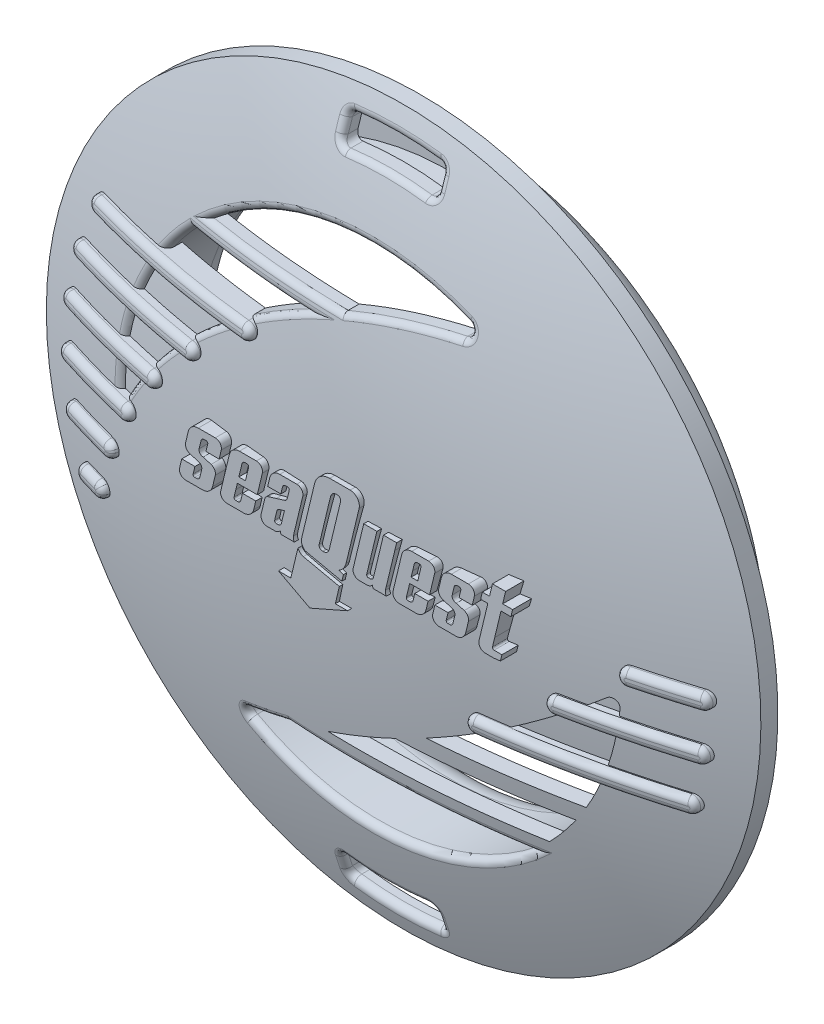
SolidWorks part; units mm, degrees
ref_plane "Plane1" through (0, 0, 0) normal (0, 0, 1) x (1, 0, 0)
ref_plane "Plane2" through (0, 0, 0) normal (0, 1, 0) x (1, 0, 0)
ref_plane "Plane3" through (0, 0, 0) normal (1, 0, 0) x (0, 0, -1)
sketch "Sketch1" plane through (0, 0, 0) normal (1, 0, 0) x (0, 0, -1)
  line L0 (0, 0) -> (10.1709, 0) construction
  line L1 (5.0468, 28.448) -> (6.4007, 28.448)
  line L2 (0, 0) -> (1.27, 0)
  arc A0 (0, 0) -> (5.0468, 28.448) centre (82.7024, 0) cw
  arc A1 (1.27, 0) -> (6.4007, 28.448) centre (82.7024, 0) cw
  point P6 (5.0468, 28.448)
  point P8 (5.0468, -28.448)
  dimension "D1" = 1.27
  dimension "D3" = 56.896
  dimension "D4" = 5.0468
revolve "Main Body" add sketch "Sketch1" angle 180 about L0
sketch "Save Body Profile" plane through (0, 0, 0) normal (1, 0, 0) x (0, 0, -1)
  line L0 (5.0468, 28.448) -> (6.4007, 28.448) construction
  line L1 (5.4526, 28.448) -> (6.4007, 28.448)
  line L2 (0.381, 0) -> (1.27, 0)
  arc A2 (5.4526, 28.448) -> (0.381, 0) centre (82.7024, 0) ccw
  arc A3 (6.4007, 28.448) -> (1.27, 0) centre (82.7024, 0) ccw
sketch "Body Front Edge" plane through (0, 0, 0) normal (1, 0, 0) x (0, 0, -1)
  arc A0 (5.0468, 28.448) -> (5.0468, -28.448) centre (82.7024, 0) ccw construction
  arc A1 (5.0468, 28.448) -> (0, 0) centre (82.7024, 0) ccw
sketch "Sketch2" plane through (0, 0, 0) normal (1, 0, 0) x (0, 0, -1)
  line L0 (0, 0) -> (14.5861, 0) construction
  line L1 (4.29, 21.971) -> (8.763, 21.971)
  line L2 (8.763, 21.971) -> (8.763, 24.257)
  line L3 (8.763, 19.939) -> (3.7488, 19.939)
  line L4 (5.0468, 28.448) -> (6.4007, 28.448) construction
  arc A0 (6.4007, 28.448) -> (6.4007, -28.448) centre (82.7024, 0) ccw construction
  arc A1 (4.29, 21.971) -> (3.7488, 19.939) centre (82.7024, 0) ccw
  arc A2 (8.763, 19.939) -> (8.763, 24.257) centre (8.763, 22.098) ccw
  point P13 (4.29, 21.971)
  point P14 (4.29, -21.971)
  dimension "D1" = 8.509
  dimension "D2" = 8.763
  dimension "D3" = 2.032
  dimension "D4" = 2.286
revolve "Snap Ring" add sketch "Sketch2" angle 180 about L0
mirror "Boss-Mirror1"
sketch "Vent OD" plane through (0, 0, 0) normal (0, 0, 1) x (1, 0, 0)
  circle A0 centre (0, 0) radius 19.939
  circle A1 centre (0, 0) radius 19.939 construction
sketch "Sketch3" plane through (0, 0, 0) normal (0, 0, 1) x (1, 0, 0)
  line L0 (17.5822, 0) -> (-17.5822, 0) construction
  line L1 (0, -17.5822) -> (0, 17.5822) construction
  line L2 (9.3514, 17.6101) -> (-19.9105, -1.0652) construction
  arc A0 (9.3514, 17.6101) -> (-19.9105, -1.0652) centre (11.9634, -18.7452) ccw
  arc A1 (9.3514, 17.6101) -> (-19.9105, -1.0652) centre (0, 0) ccw
  circle A2 centre (0, 0) radius 19.939 construction
  dimension "D3" = 9.3514
  dimension "D1" = 1.0652
  dimension "D4" = 4.3979
extrude "Upper Left Vent Cut" cut sketch "Sketch3" against normal through all
sketch "Sketch4" plane through (0, 0, 0) normal (0, 0, 1) x (1, 0, 0)
  line L0 (19.923, -0.7977) -> (-10.6858, -16.8338) construction
  line L1 (17.5822, 0) -> (-17.5822, 0) construction
  line L2 (0, -17.5822) -> (0, 17.5822) construction
  arc A0 (19.923, -0.7977) -> (-10.6858, -16.8338) centre (-32.8422, 62.6872) cw
  arc A1 (19.923, -0.7977) -> (-10.6858, -16.8338) centre (0, 0) cw
  circle A2 centre (0, 0) radius 19.939 construction
  dimension "D3" = 1.8283
  dimension "D1" = 0.7977
  dimension "D2" = 10.6858
extrude "Lower Right Vent Cut" cut sketch "Sketch4" against normal through all
sketch "Sketch6" plane through (0, 0, 0) normal (1, 0, 0) x (0, 0, -1)
  line L0 (0, 0) -> (12.1279, 0) construction
  line L1 (5.4526, 28.448) -> (6.4007, 28.448)
  line L2 (0.381, 0) -> (1.27, 0)
  arc A0 (1.27, 0) -> (6.4007, 28.448) centre (82.7024, 0) cw
  arc A1 (5.4526, 28.448) -> (0.381, 0) centre (82.7024, 0) ccw
  arc A2 (5.4526, 28.448) -> (0.381, 0) centre (82.7024, 0) ccw construction
  arc A3 (6.4007, 28.448) -> (1.27, 0) centre (82.7024, 0) ccw construction
revolve "Back Fill In Vent" add sketch "Sketch6" angle 360 about L0
sketch "Front Rib OD" plane through (0, 0, 0) normal (0, 0, 1) x (1, 0, 0)
  line L0 (-7.4453, 28.448) -> (8.1222, 28.448) construction
  circle A0 centre (0, 0) radius 25.8445
  circle A1 centre (0, 0) radius 28.448 construction
  arc A3 (-11.0266, -15.6104) -> (19.1113, 0.179) centre (-32.8422, 62.6872) ccw
  arc A4 (-11.0266, -15.6104) -> (19.1113, 0.179) centre (-32.8422, 62.6872) ccw
  arc A6 (9.4424, 16.3434) -> (-18.7999, -1.6812) centre (11.9634, -18.7452) ccw
  arc A7 (9.4424, 16.3434) -> (-18.7999, -1.6812) centre (11.9634, -18.7452) ccw
  dimension "D1" = 1.27
  dimension "D2" = 2.6035
  dimension "D3" = 1.27
sketch "Sketch11" plane through (0, 0, 0) normal (0, 0, 1) x (1, 0, 0)
  line L0 (-21.7434, 15.24) -> (2.8767, 15.24)
  line L1 (-21.7434, 15.24) -> (-21.7434, 13.97)
  line L2 (2.8767, 13.97) -> (-21.7434, 13.97)
  line L3 (2.8767, 13.97) -> (2.8767, 15.24)
  line L4 (17.5822, 0) -> (-17.5822, 0) construction
  circle A0 centre (0, 0) radius 25.8445 construction
  arc A1 (9.4424, 16.3434) -> (-18.7999, -1.6812) centre (11.9634, -18.7452) ccw construction
  dimension "D1" = 1.27
  dimension "D2" = 13.97
extrude "Left Vent Divider" add sketch "Sketch11" against normal up to next
sketch "Sketch12" plane through (0, 0, 0) normal (0, 0, 1) x (1, 0, 0)
  line L0 (0.5206, -10.16) -> (23.7637, -10.16)
  line L1 (0.5206, -10.16) -> (0.5206, -11.43)
  line L2 (23.7637, -11.43) -> (0.5206, -11.43)
  line L3 (23.7637, -11.43) -> (23.7637, -10.16)
  line L4 (17.5822, 0) -> (-17.5822, 0) construction
  circle A0 centre (0, 0) radius 25.8445 construction
  arc A1 (-11.0266, -15.6104) -> (19.1113, 0.179) centre (-32.8422, 62.6872) ccw construction
  dimension "D1" = 1.27
  dimension "D2" = 10.16
extrude "Right Vent Divider" add sketch "Sketch12" against normal up to next
pattern_linear "Pattern Right Vent Divider" count 2 spacing 3.81 of "Right Vent Divider"
sketch "Sketch14" plane through (0, 0, 0) normal (1, 0, 0) x (0, 0, -1)
  line L0 (0, 0) -> (-2.54, 0)
  line L1 (-2.54, 0) -> (-2.54, 28.448)
  line L2 (-2.54, 28.448) -> (5.0468, 28.448)
  line L3 (0, 0) -> (-2.54, 0) construction
  arc A0 (5.0468, 28.448) -> (0, 0) centre (82.7024, 0) ccw
  arc A1 (5.0468, 28.448) -> (0, 0) centre (82.7024, 0) ccw construction
  dimension "D1" = 2.54
revolve "Trim Front of Dividers" cut sketch "Sketch14" angle 360 about L3
sketch "Sketch9" plane through (0, 0, 0) normal (0, 0, 1) x (1, 0, 0)
  line L0 (25.2015, 1.27) -> (20.633, 1.27)
  line L1 (20.633, 0) -> (25.2015, 0)
  line L2 (31.4196, 6.35) -> (19.9962, 6.35) construction
  line L3 (17.5822, 0) -> (-17.5822, 0) construction
  arc A0 (25.2015, 1.27) -> (25.2015, 0) centre (25.2015, 0.635) cw
  arc A1 (20.633, 0) -> (20.633, 1.27) centre (20.633, 0.635) cw
  arc A2 (-11.0266, -15.6104) -> (19.1113, 0.179) centre (-32.8422, 62.6872) ccw construction
  circle A3 centre (0, 0) radius 25.8445 construction
  dimension "D1" = 1.27
  dimension "D2" = 6.35
  dimension "D3" = 6.35
extrude "Right Side Ribs" add sketch "Sketch9" along normal blind 3.175 and the other way up to next
pattern_linear "Pattern Right Side Ribs" count 3 spacing 3.81 of "Right Side Ribs"
sketch "Sketch10" plane through (0, 0, 0) normal (0, 0, 1) x (1, 0, 0)
  line L0 (-23.8196, -7.62) -> (-22.2798, -7.62)
  line L1 (-22.2798, -8.89) -> (-23.8196, -8.89)
  line L2 (-29.222, -8.89) -> (-15.4173, -8.89) construction
  line L3 (17.5822, 0) -> (-17.5822, 0) construction
  arc A0 (-23.8196, -8.89) -> (-23.8196, -7.62) centre (-23.8196, -8.255) cw
  arc A1 (-22.2798, -7.62) -> (-22.2798, -8.89) centre (-22.2798, -8.255) cw
  circle A2 centre (0, 0) radius 25.8445 construction
  arc A3 (9.4424, 16.3434) -> (-18.7999, -1.6812) centre (11.9634, -18.7452) ccw construction
  dimension "D1" = 1.27
  dimension "D2" = 8.89
  dimension "D3" = 1.27
extrude "Left Side Ribs" add sketch "Sketch10" along normal blind 3.175 and the other way up to next
pattern_linear "Pattern Left Side Ribs" count 6 spacing 3.81 of "Left Side Ribs"
sketch "Sketch15" plane through (0, 0, 0) normal (1, 0, 0) x (0, 0, -1)
  line L0 (-0.635, 0) -> (-3.175, 0)
  line L1 (-3.175, 0) -> (-3.175, 28.448)
  line L2 (-3.175, 28.448) -> (4.3708, 28.448)
  line L3 (17.5822, 0) -> (-17.5822, 0) construction
  line L4 (0, 17.5822) -> (0, -17.5822) construction
  line L5 (-3.175, 11.43) -> (-3.175, 10.16) construction
  line L6 (-0.635, 0) -> (-3.175, 0) construction
  arc A0 (4.3708, 28.448) -> (-0.635, 0) centre (82.7024, 0) ccw
  arc A1 (5.0468, 28.448) -> (0, 0) centre (82.7024, 0) ccw construction
  dimension "D1" = 0.635
revolve "Trim Ribs" cut sketch "Sketch15" angle 360 about L6
sketch "Sketch16" plane through (0, 0, 0) normal (0, 0, 1) x (1, 0, 0)
  line L0 (-12.8571, 15.24) -> (-1.2099, 15.24) construction
  line L1 (-12.8571, 15.24) -> (-1.2099, 15.24)
  line L2 (-16.3377, 11.43) -> (-8.4813, 11.43) construction
  line L3 (-16.3377, 11.43) -> (-8.4813, 11.43)
  line L4 (-4.1066, 13.97) -> (-14.2268, 13.97) construction
  line L5 (-4.1066, 13.97) -> (-14.2268, 13.97)
  line L6 (12.8571, -15.24) -> (-5.6052, -15.24) construction
  line L7 (12.8571, -15.24) -> (-5.6052, -15.24)
  line L8 (-2.2125, -13.97) -> (14.2268, -13.97) construction
  line L9 (-2.2125, -13.97) -> (14.2268, -13.97)
  line L10 (16.3377, -11.43) -> (3.5053, -11.43) construction
  line L11 (16.3377, -11.43) -> (3.5053, -11.43)
  line L12 (5.988, -10.16) -> (17.1563, -10.16) construction
  line L13 (5.988, -10.16) -> (17.1563, -10.16)
  line L14 (10.4175, -7.62) -> (18.4255, -7.62) construction
  line L15 (10.4175, -7.62) -> (18.4255, -7.62)
  arc A0 (9.3514, 17.6101) -> (-1.2099, 15.24) centre (11.9634, -18.7452) ccw construction
  arc A1 (9.3514, 17.6101) -> (-1.2099, 15.24) centre (11.9634, -18.7452) ccw
  arc A2 (9.3514, 17.6101) -> (-12.8571, 15.24) centre (0, 0) ccw construction
  arc A3 (9.3514, 17.6101) -> (-12.8571, 15.24) centre (0, 0) ccw
  arc A4 (-14.2268, 13.97) -> (-16.3377, 11.43) centre (0, 0) ccw construction
  arc A5 (-14.2268, 13.97) -> (-16.3377, 11.43) centre (0, 0) ccw
  arc A6 (-4.1066, 13.97) -> (-8.4813, 11.43) centre (11.9634, -18.7452) ccw construction
  arc A7 (-4.1066, 13.97) -> (-8.4813, 11.43) centre (11.9634, -18.7452) ccw
  arc A8 (-10.6858, -16.8338) -> (12.8571, -15.24) centre (0, 0) ccw construction
  arc A9 (-10.6858, -16.8338) -> (12.8571, -15.24) centre (0, 0) ccw
  arc A10 (14.2268, -13.97) -> (16.3377, -11.43) centre (0, 0) ccw construction
  arc A11 (14.2268, -13.97) -> (16.3377, -11.43) centre (0, 0) ccw
  arc A12 (17.1563, -10.16) -> (18.4255, -7.62) centre (0, 0) ccw construction
  arc A13 (17.1563, -10.16) -> (18.4255, -7.62) centre (0, 0) ccw
  arc A14 (-10.6858, -16.8338) -> (-5.6052, -15.24) centre (-32.8422, 62.6872) ccw construction
  arc A15 (-10.6858, -16.8338) -> (-5.6052, -15.24) centre (-32.8422, 62.6872) ccw
  arc A16 (5.988, -10.16) -> (10.4175, -7.62) centre (-32.8422, 62.6872) ccw construction
  arc A17 (5.988, -10.16) -> (10.4175, -7.62) centre (-32.8422, 62.6872) ccw
extrude "Re Open Vents" cut sketch "Sketch16" against normal through all
fillet "Fillet the Ribs" radius 0.508 36 edges at (-15.5959, 11.43, -1.6392) (20.4689, -2.54, -1.9578) (20.469, -3.81, -2.0077) (17.2941, -6.35, -1.4268) (17.2942, -7.62, -1.5361) (22.9265, 1.27, -2.5907) (22.9265, 0, -2.5806) (25.8337, 0.575, -3.4723) (20.0001, 0.6871, -1.8034) (25.64, -3.2439, -3.4737) (15.2305, -3.1235, -0.8281) (24.853, -7.0601, -3.4711) (9.6041, -6.9384, -0.2115) (-23.0508, -8.89, -3.1113) (-24.4536, -8.2191, -3.4585) (-23.0508, -7.62, -2.9796) (-21.6458, -8.2894, -2.6532) (-22.8501, -5.08, -2.72) (-25.4477, -4.3963, -3.4672) (-22.8501, -3.81, -2.6494) (-20.2382, -4.4884, -1.9844) (-22.0847, -1.27, -2.3546) (-25.8337, -0.575, -3.4723) (-22.0847, 0, -2.3445) (-18.3012, -0.6846, -1.4022) (-20.7136, 2.54, -2.0202) (-25.64, 3.2439, -3.4737) (-20.7136, 3.81, -2.0702) (-15.726, 3.1227, -0.9218) (-18.6307, 6.35, -1.7228) (-24.853, 7.0601, -3.4711) (-18.6308, 7.62, -1.8324) (-12.3155, 6.9341, -0.5722) (-15.5956, 10.16, -1.4702) (-23.4115, 10.8728, -3.4635) (-7.652, 10.7511, -0.4164)
fillet "Fillet13" radius 0.508 1 edges at (9.3514, 17.6101, -3.0942)
fillet "Fillet8" radius 0.508 33 edges at (-9.1847, 13.97, -1.7075) (-7.0518, 15.24, -1.7228) (-19.8983, 1.2726, -2.4396) (-19.296, 0, -2.4785) (-19.939, 0, -2.6359) (-18.305, -0.7203, -2.0544) (-19.2781, 5.0911, -2.4396) (-17.6249, 2.54, -2.1349) (-16.6686, 3.81, -1.9816) (-15.7301, 3.0861, -1.5684) (-19.5716, 3.81, -2.6359) (-19.7766, 2.54, -2.6359) (-17.8362, 8.9126, -2.4396) (-14.4707, 6.35, -1.7179) (-13.2042, 7.62, -1.6111) (-12.3196, 6.8967, -1.2141) (-18.4255, 7.62, -2.6359) (-18.9008, 6.35, -2.6359) (-15.3349, 12.7438, -2.4396) (-10.2406, 10.16, -1.4613) (-7.6559, 10.7129, -1.0549) (-17.1563, 10.16, -2.6359) (7.9728, 17.8638, -2.3469) (-3.0406, 19.7058, -2.4396)
fillet "Fillet14" radius 0.508 4 edges at (19.923, -0.7977, -2.6359) (-10.6858, -16.8338, -3.0942)
fillet "Fillet17" radius 0.508 5 edges at (3.6496, -15.24, -1.4983) (1.9411, -19.8443, -2.4396) (-9.9206, -17.0377, -2.3844)
sketch "Sketch17" plane through (0, 0, 0) normal (0, 0, 1) x (1, 0, 0)
  line L0 (-3.81, 24.2131) -> (-3.81, 26.2681)
  line L1 (3.81, 24.2131) -> (3.81, 26.2681)
  line L2 (0, 0) -> (0, 11.9695) construction
  line L3 (0, 0) -> (13.887, 0) construction
  line L4 (3.81, -24.2131) -> (3.81, -26.2681)
  line L5 (-3.81, -24.2131) -> (-3.81, -26.2681)
  arc A0 (3.81, 26.2681) -> (-3.81, 26.2681) centre (0, 0) ccw
  arc A1 (3.81, 24.2131) -> (-3.81, 24.2131) centre (0, 0) ccw
  arc A2 (3.81, -24.2131) -> (-3.81, -24.2131) centre (0, 0) cw
  arc A3 (3.81, -26.2681) -> (-3.81, -26.2681) centre (0, 0) cw
  dimension "D2" = 24.511
  dimension "D3" = 26.543
  dimension "D1" = 7.62
extrude "Tooling Holes" cut sketch "Sketch17" against normal up to surface (5.0464 mm away)
fillet "Fillet34" radius 0.508 16 edges at (-3.81, 26.2681, -5.0462) (0, 26.543, -4.3752) (3.81, 26.2681, -5.0462) (3.81, 25.2428, -4.0387) (3.81, 24.2131, -4.3811) (-3.81, 24.2131, -4.3811) (0, 24.511, -3.7157) (-3.81, 25.2428, -4.0387) (-3.81, -26.2681, -5.0462) (-3.81, -25.2428, -4.0387) (3.81, -26.2681, -5.0462) (3.81, -24.2131, -4.3811) (-3.81, -24.2131, -4.3811) (0, -24.511, -3.7157) (0, -26.543, -4.3752) (3.81, -25.2428, -4.0387)
ref_plane "Logo Plane" through (0, 0, 0.254) normal (0, 0, 1) x (1, 0, 0)
sketch "Sketch19" plane through (0, 0, 0.254) normal (0, 0, 1) x (1, 0, 0)
  line L0 (0.5084, -1.0819) -> (0.1494, -0.9527)
  line L1 (-2.8127, -0.2099) -> (-1.7801, 4.081)
  line L2 (0.5084, -1.0819) -> (0.3857, -1.592)
  line L3 (0.1839, -2.051) -> (-0.1342, -3.4035)
  line L4 (-0.1342, -3.4035) -> (0.841, -3.4035)
  line L5 (-3.6786, -3.4035) -> (-4.6612, -3.4035)
  line L6 (-4.6612, -3.4035) -> (-2.159, -4.7169)
  line L7 (-3.1148, -1.0607) -> (-3.6786, -3.4035)
  line L8 (-2.684, -1.4269) -> (0.1839, -2.051)
  line L9 (0.841, -3.4035) -> (-2.159, -4.7169)
  line L10 (2.1266, 3.2425) -> (3.1746, 3.2425)
  line L11 (3.1746, 3.2425) -> (2.5397, 0.604)
  line L12 (1.2872, -0.2454) -> (2.1266, 3.2425)
  line L13 (0.0314, 4.1867) -> (-0.0351, 4.1867)
  line L14 (-5.5197, 1.9968) -> (-4.4716, 1.9969)
  line L15 (-4.1969, 1.7014) -> (-4.8326, 1.5055)
  line L16 (-4.5592, 3.307) -> (-3.2077, 3.307)
  line L17 (-7.7755, 3.2978) -> (-6.4239, 3.2978)
  line L18 (-7.0349, 2.5723) -> (-7.2938, 1.4964)
  line L19 (-7.5683, 2.5332) -> (-7.8178, 1.4964)
  line L20 (-5.9463, 2.6916) -> (-6.3521, 1.0051)
  line L21 (-8.5716, 2.6705) -> (-9.26, -0.1901)
  line L22 (-11.8448, 2.6272) -> (-12.0581, 1.7411)
  line L23 (-7.2938, 1.4964) -> (-7.8178, 1.4964)
  line L24 (-11.0487, 3.2545) -> (-9.6972, 3.2545)
  line L25 (-6.3521, 1.0051) -> (-7.9361, 1.0051)
  line L26 (-7.1623, 2.734) -> (-7.3136, 2.734)
  line L27 (-5.4683, 1.3097) -> (-4.8326, 1.5055)
  line L28 (-11.7251, 1.1567) -> (-10.9964, 0.9322)
  line L29 (-9.3889, 1.9444) -> (-9.2195, 2.6482)
  line L30 (-10.982, 1.8572) -> (-10.8281, 2.497)
  line L31 (-10.2946, 2.536) -> (-10.437, 1.9444)
  line L32 (-10.6636, 1.4531) -> (-10.0279, 1.2572)
  line L33 (-9.3889, 1.9444) -> (-10.437, 1.9444)
  line L34 (-2.73, 2.7007) -> (-3.479, -0.4118)
  line L35 (-4.4716, 1.9969) -> (-4.3386, 2.5495)
  line L36 (-10.422, 2.6977) -> (-10.5733, 2.6977)
  line L37 (-3.8051, 2.5885) -> (-3.9607, 1.9422)
  line L38 (-4.1829, 1.7057) -> (-4.1969, 1.7014)
  line L39 (-3.9325, 2.7502) -> (-4.0839, 2.7502)
  line L40 (1.7649, -0.8516) -> (2.4429, -0.8516)
  line L41 (-5.3553, 2.6797) -> (-5.5197, 1.9968)
  line L42 (2.641, -0.2948) -> (2.4897, -0.2948)
  line L43 (-4.7912, 0.6684) -> (-4.9686, -0.0687)
  line L44 (2.5397, 0.604) -> (2.3623, -0.1331)
  line L45 (-4.888, -0.7872) -> (-5.5661, -0.7872)
  line L46 (-7.5185, 0.5138) -> (-7.5303, 0.5138)
  line L47 (-7.5185, 0.5138) -> (-6.4704, 0.5138)
  line L48 (-7.9197, -0.2466) -> (-8.071, -0.2466)
  line L49 (-8.7823, -0.7963) -> (-7.4308, -0.7963)
  line L50 (-8.056, 0.5067) -> (-8.1984, -0.0849)
  line L51 (-7.5303, 0.5138) -> (-7.6649, -0.0459)
  line L52 (-6.4704, 0.5138) -> (-6.6347, -0.1691)
  line L53 (-4.8412, -0.2304) -> (-4.6899, -0.2304)
  line L54 (-4.6136, 0.8575) -> (-4.1903, 0.9879)
  line L55 (-12.3639, 0.4705) -> (-11.3158, 0.4705)
  line L56 (-11.1795, -0.2829) -> (-11.3308, -0.2829)
  line L57 (-10.704, -0.8396) -> (-12.0556, -0.8396)
  line L58 (-11.3158, 0.4705) -> (-11.4581, -0.1212)
  line L59 (-12.3639, 0.4705) -> (-12.5332, -0.2334)
  line L60 (-9.9079, -0.2124) -> (-9.6949, 0.6728)
  line L61 (-10.7744, 0.5425) -> (-10.9247, -0.0821)
  line L62 (-1.1655, -0.2841) -> (-1.0991, -0.2841)
  line L63 (-4.4462, -0.7867) -> (-3.3978, -0.7854)
  line L64 (-2.5668, -0.9496) -> (0.3857, -1.592)
  line L65 (-0.6214, 0.0922) -> (0.2861, 3.8633)
  line L66 (-4.4352, -0.0297) -> (-4.1903, 0.9879)
  line L67 (0.7259, -0.1784) -> (1.7585, 4.1125)
  line L68 (-7.9361, 1.0051) -> (-8.056, 0.5067)
  line L69 (-5.7324, 1.1126) -> (-6.0437, -0.1809)
  line L70 (4.4601, -0.2389) -> (5.1485, 2.6218)
  line L71 (4.9378, -0.8451) -> (6.2893, -0.8451)
  line L72 (-0.586, 5.0219) -> (1.042, 5.0219)
  line L73 (10.935, 2.6483) -> (10.7656, 1.9444)
  line L74 (6.4263, 1.4476) -> (6.6852, 2.5235)
  line L75 (7.368, 0.9563) -> (7.7738, 2.6428)
  line L76 (8.4295, 1.1567) -> (9.1582, 0.9322)
  line L77 (-0.5127, 3.8103) -> (-1.4202, 0.0392)
  line L78 (9.1725, 1.8572) -> (9.3265, 2.497)
  line L79 (8.0965, 1.7411) -> (8.3097, 2.6272)
  line L80 (3.6987, 3.2425) -> (4.7468, 3.2425)
  line L81 (4.7468, 3.2425) -> (4.6009, 2.6363)
  line L82 (3.9125, -0.2244) -> (3.8519, -0.4763)
  line L83 (3.1164, -0.8516) -> (3.7615, -0.8516)
  line L84 (3.7615, -0.8516) -> (3.9325, -0.8516)
  line L85 (2.8841, -0.8516) -> (3.1164, -0.8516)
  line L86 (9.4909, 1.4531) -> (10.1266, 1.2572)
  line L87 (3.1406, 0.9235) -> (2.8957, -0.0941)
  line L88 (4.6009, 2.6363) -> (3.9125, -0.2244)
  line L89 (3.6987, 3.2425) -> (3.1406, 0.9235)
  line L90 (11.3023, -0.238) -> (12.0069, 2.6902)
  line L91 (11.7799, -0.8443) -> (12.4579, -0.8443)
  line L92 (10.2466, -0.2124) -> (10.4596, 0.6728)
  line L93 (12.3756, 4.222) -> (13.4237, 4.222)
  line L94 (12.1416, 3.2499) -> (11.5694, 3.2499)
  line L95 (5.5217, -0.1337) -> (5.784, 0.9563)
  line L96 (5.6491, -0.2954) -> (5.8004, -0.2954)
  line L97 (11.4347, 2.6902) -> (12.0069, 2.6902)
  line L98 (9.8599, 2.536) -> (9.7175, 1.9444)
  line L99 (10.7656, 1.9444) -> (9.7175, 1.9444)
  line L100 (11.5694, 3.2499) -> (11.4347, 2.6902)
  line L101 (12.3756, 4.222) -> (12.1416, 3.2499)
  line L102 (7.2962, 3.249) -> (5.9446, 3.249)
  line L103 (6.4263, 1.4476) -> (5.9023, 1.4476)
  line L104 (6.1518, 2.4844) -> (6.0205, 1.9389)
  line L105 (6.0205, 1.9389) -> (5.9023, 1.4476)
  line L106 (8.6964, -0.1212) -> (8.8388, 0.4705)
  line L107 (8.8238, -0.2829) -> (8.9751, -0.2829)
  line L108 (7.0854, -0.2179) -> (7.2497, 0.465)
  line L109 (8.0989, -0.8396) -> (9.4505, -0.8396)
  line L110 (7.6213, -0.2334) -> (7.7907, 0.4705)
  line L112 (6.5578, 2.6852) -> (6.4065, 2.6852)
  line L113 (10.4573, 3.2545) -> (9.1058, 3.2545)
  line L115 (9.7325, 2.6977) -> (9.5812, 2.6977)
  line L116 (13.4237, 4.222) -> (13.1897, 3.2499)
  line L117 (13.1897, 3.2499) -> (13.9797, 3.2499)
  line L118 (13.055, 2.6902) -> (13.845, 2.6902)
  line L119 (13.9797, 3.2499) -> (13.845, 2.6902)
  line L120 (12.4579, -0.8443) -> (13.0094, -0.7818)
  line L121 (12.6561, -0.2875) -> (12.5048, -0.2875)
  line L124 (12.5548, 0.6113) -> (12.3774, -0.1258)
  line L125 (7.368, 0.9563) -> (5.784, 0.9563)
  line L126 (6.2017, 0.465) -> (7.2497, 0.465)
  line L127 (6.2017, 0.465) -> (6.1899, 0.465)
  line L130 (6.1899, 0.465) -> (6.0552, -0.0946)
  line L133 (9.3802, 0.5425) -> (9.2298, -0.0821)
  line L134 (7.7907, 0.4705) -> (8.8388, 0.4705)
  line L140 (13.1284, -0.2875) -> (13.0094, -0.7818)
  line L141 (12.6561, -0.2875) -> (13.1284, -0.2875)
  line L142 (13.055, 2.6902) -> (12.5548, 0.6113)
  arc A0 (-3.1148, -1.0607) -> (-2.684, -1.4269) centre (-2.4639, -0.7316) ccw
  arc A1 (2.641, -0.2948) -> (2.8957, -0.0941) centre (2.641, -0.0328) ccw
  arc A2 (2.4429, -0.8516) -> (2.8241, -0.6168) centre (2.3521, -0.2773) ccw
  arc A3 (-0.0351, 4.1867) -> (-0.5127, 3.8103) centre (-0.0351, 3.6954) ccw
  arc A4 (0.2861, 3.8633) -> (0.0314, 4.1867) centre (0.0313, 3.9247) ccw
  arc A5 (-4.5592, 3.307) -> (-5.3553, 2.6797) centre (-4.5592, 2.4881) ccw
  arc A6 (-5.4683, 1.3097) -> (-5.7324, 1.1126) centre (-5.3236, 0.8402) ccw
  arc A7 (-7.0349, 2.5723) -> (-7.1623, 2.734) centre (-7.1623, 2.6029) ccw
  arc A8 (-7.3136, 2.734) -> (-7.5683, 2.5332) centre (-7.3136, 2.4719) ccw
  arc A9 (-5.9463, 2.6916) -> (-6.4239, 3.2978) centre (-6.4239, 2.8065) ccw
  arc A10 (-7.7755, 3.2978) -> (-8.5716, 2.6705) centre (-7.7755, 2.479) ccw
  arc A11 (-11.0487, 3.2545) -> (-11.8448, 2.6272) centre (-11.0487, 2.4357) ccw
  arc A12 (-12.0581, 1.7411) -> (-11.7251, 1.1567) centre (-11.5804, 1.6262) ccw
  arc A13 (-10.982, 1.8572) -> (-10.6636, 1.4531) centre (-10.6636, 1.7806) ccw
  arc A14 (-10.2946, 2.536) -> (-10.422, 2.6977) centre (-10.422, 2.5667) ccw
  arc A15 (-10.5733, 2.6977) -> (-10.8281, 2.497) centre (-10.5733, 2.4357) ccw
  arc A16 (-9.2195, 2.6482) -> (-9.6972, 3.2545) centre (-9.6972, 2.7632) ccw
  arc A17 (-4.1829, 1.7057) -> (-3.9607, 1.9422) centre (-4.2791, 2.0188) ccw
  arc A18 (-3.8051, 2.5885) -> (-3.9325, 2.7502) centre (-3.9325, 2.6192) ccw
  arc A19 (-2.73, 2.7007) -> (-3.2077, 3.307) centre (-3.2077, 2.8157) ccw
  arc A20 (-4.0839, 2.7502) -> (-4.3386, 2.5495) centre (-4.0838, 2.4881) ccw
  arc A21 (2.3623, -0.1331) -> (2.4897, -0.2948) centre (2.4897, -0.1638) ccw
  arc A22 (1.2872, -0.2454) -> (1.7649, -0.8516) centre (1.7649, -0.3603) ccw
  arc A23 (0.1494, -0.9527) -> (0.7259, -0.1784) centre (-0.4683, 0.1089) ccw
  arc A24 (-4.6136, 0.8575) -> (-4.7912, 0.6684) centre (-4.5365, 0.6071) ccw
  arc A25 (-4.888, -0.7872) -> (-4.5068, -0.5523) centre (-4.9788, -0.2129) ccw
  arc A26 (-4.6899, -0.2304) -> (-4.4352, -0.0297) centre (-4.6899, 0.0316) ccw
  arc A27 (-7.4308, -0.7963) -> (-6.6347, -0.1691) centre (-7.4308, 0.0225) ccw
  arc A28 (-7.9197, -0.2466) -> (-7.6649, -0.0459) centre (-7.9197, 0.0154) ccw
  arc A29 (-8.1984, -0.0849) -> (-8.071, -0.2466) centre (-8.071, -0.1156) ccw
  arc A30 (-6.0437, -0.1809) -> (-5.5661, -0.7872) centre (-5.5661, -0.2959) ccw
  arc A31 (-4.9686, -0.0687) -> (-4.8412, -0.2304) centre (-4.8412, -0.0994) ccw
  arc A32 (-12.5332, -0.2334) -> (-12.0556, -0.8396) centre (-12.0556, -0.3484) ccw
  arc A33 (-11.4581, -0.1212) -> (-11.3308, -0.2829) centre (-11.3308, -0.1518) ccw
  arc A34 (-11.1795, -0.2829) -> (-10.9247, -0.0821) centre (-11.1795, -0.0208) ccw
  arc A35 (-10.704, -0.8396) -> (-9.9079, -0.2124) centre (-10.704, -0.0208) ccw
  arc A36 (-9.26, -0.1901) -> (-8.7823, -0.7963) centre (-8.7823, -0.305) ccw
  arc A37 (-1.4202, 0.0392) -> (-1.1655, -0.2841) centre (-1.1655, -0.0221) ccw
  arc A38 (-3.479, -0.4118) -> (-3.3978, -0.7854) centre (-2.9632, -0.4953) ccw
  arc A39 (-2.8127, -0.2099) -> (-2.5668, -0.9496) centre (-2.0962, -0.3824) ccw
  arc A40 (-4.5068, -0.5523) -> (-4.4462, -0.7867) centre (-4.1418, -0.5831) ccw
  arc A41 (-1.0991, -0.2841) -> (-0.6214, 0.0922) centre (-1.0991, 0.2072) ccw
  arc A42 (-9.6949, 0.6728) -> (-10.0279, 1.2572) centre (-10.1726, 0.7877) ccw
  arc A43 (-10.7744, 0.5425) -> (-10.9964, 0.9322) centre (-11.0928, 0.6191) ccw
  arc A44 (3.8519, -0.4763) -> (3.9325, -0.8516) centre (4.3673, -0.5619) ccw
  arc A45 (2.8241, -0.6168) -> (2.8841, -0.8516) centre (3.1885, -0.6488) ccw
  arc A46 (4.4601, -0.2389) -> (4.9378, -0.8451) centre (4.9378, -0.3538) ccw
  arc A47 (1.7585, 4.1125) -> (1.042, 5.0219) centre (1.042, 4.285) ccw
  arc A48 (-0.586, 5.0219) -> (-1.7801, 4.081) centre (-0.586, 3.7936) ccw
  arc A49 (9.8599, 2.536) -> (9.7325, 2.6977) centre (9.7325, 2.5667) ccw
  arc A50 (10.935, 2.6483) -> (10.4573, 3.2545) centre (10.4573, 2.7632) ccw
  arc A51 (6.4065, 2.6852) -> (6.1518, 2.4844) centre (6.4065, 2.4231) ccw
  arc A52 (5.9446, 3.249) -> (5.1485, 2.6218) centre (5.9446, 2.4302) ccw
  arc A53 (9.1725, 1.8572) -> (9.4909, 1.4531) centre (9.4909, 1.7806) ccw
  arc A54 (8.0965, 1.7411) -> (8.4295, 1.1567) centre (8.5741, 1.6262) ccw
  arc A55 (9.5812, 2.6977) -> (9.3265, 2.497) centre (9.5812, 2.4357) ccw
  arc A56 (6.6852, 2.5235) -> (6.5578, 2.6852) centre (6.5579, 2.5541) ccw
  arc A57 (9.1058, 3.2545) -> (8.3097, 2.6272) centre (9.1058, 2.4357) ccw
  arc A58 (7.7738, 2.6428) -> (7.2962, 3.249) centre (7.2962, 2.7577) ccw
  arc A59 (11.3023, -0.238) -> (11.7799, -0.8443) centre (11.7799, -0.353) ccw
  arc A60 (12.3774, -0.1258) -> (12.5048, -0.2875) centre (12.5048, -0.1565) ccw
  arc A61 (5.8004, -0.2954) -> (6.0552, -0.0946) centre (5.8004, -0.0333) ccw
  arc A62 (5.5217, -0.1337) -> (5.6491, -0.2954) centre (5.6491, -0.1643) ccw
  arc A63 (8.6964, -0.1212) -> (8.8238, -0.2829) centre (8.8238, -0.1518) ccw
  arc A64 (6.2893, -0.8451) -> (7.0854, -0.2179) centre (6.2893, -0.0263) ccw
  arc A65 (7.6213, -0.2334) -> (8.0989, -0.8396) centre (8.0989, -0.3484) ccw
  arc A66 (8.9751, -0.2829) -> (9.2298, -0.0821) centre (8.9751, -0.0208) ccw
  arc A67 (9.4505, -0.8396) -> (10.2466, -0.2124) centre (9.4505, -0.0208) ccw
  arc A68 (10.4596, 0.6728) -> (10.1266, 1.2572) centre (9.9819, 0.7877) ccw
  arc A69 (9.3802, 0.5425) -> (9.1582, 0.9322) centre (9.0617, 0.6192) ccw
extrude "Logo" add sketch "Sketch19" against normal up to next
